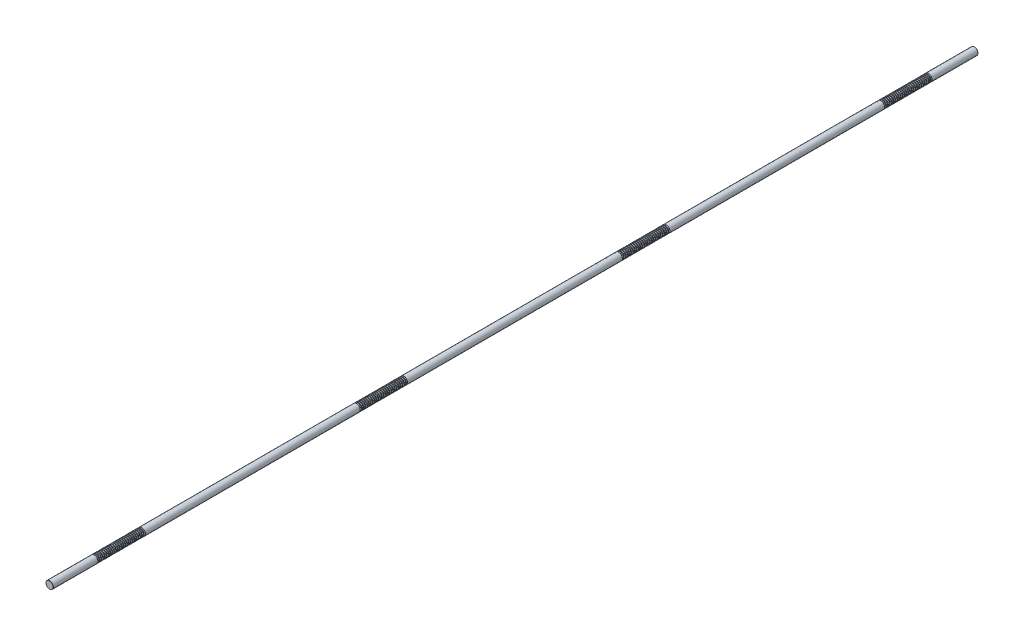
SolidWorks part; units mm, degrees
ref_plane "Front Plane" through (0, 0, 0) normal (0, 0, 1) x (1, 0, 0)
ref_plane "Top Plane" through (0, 0, 0) normal (0, 1, 0) x (1, 0, 0)
ref_plane "Right Plane" through (0, 0, 0) normal (1, 0, 0) x (0, 0, -1)
sketch "Sketch1" plane through (0, 0, 0) normal (0, 0, 1) x (1, 0, 0)
  circle A0 centre (0, 0) radius 8
  dimension "D1" = 16
extrude "Boss-Extrude1" add sketch "Sketch1" along normal mid plane 2000
chamfer "Chamfer1" distance 0.4 angle 45 2 edges at (8, 0, -1000) (8, 0, 1000)
sketch "Sketch2" plane through (0, 0, 0) normal (1, 0, 0) x (0, 0, -1)
  line L0 (900.3014, 8) -> (897.6986, 8)
  line L1 (999.6, 8) -> (-999.6, 8) construction
  line L2 (897.6986, 8) -> (898.3014, 5.75)
  line L3 (898.3014, 5.75) -> (899.6986, 5.75)
  line L4 (899.6986, 5.75) -> (900.3014, 8)
  line L5 (1000, -7.6) -> (1000, 7.6) construction
  point P4 (899, 8)
  point P7 (899, 5.75)
  point P8 (900, 6.875)
  point P9 (898, 6.875)
  dimension "D1" = 2
  dimension "D2" = 100
  dimension "D3" = 2.25
  dimension "D4" = 30
revolve "Cut-Revolve1" cut sketch "Sketch2" angle 360 about axis through (0, 0, 1000) along (0, 0, -1)
pattern_linear "LPattern1" count 26 spacing 4 along (0, 0, 1) of "Cut-Revolve1"
pattern_linear "LPattern2" count 4 spacing 567 along (0, 0, 1) of "Cut-Revolve1", "LPattern1"
